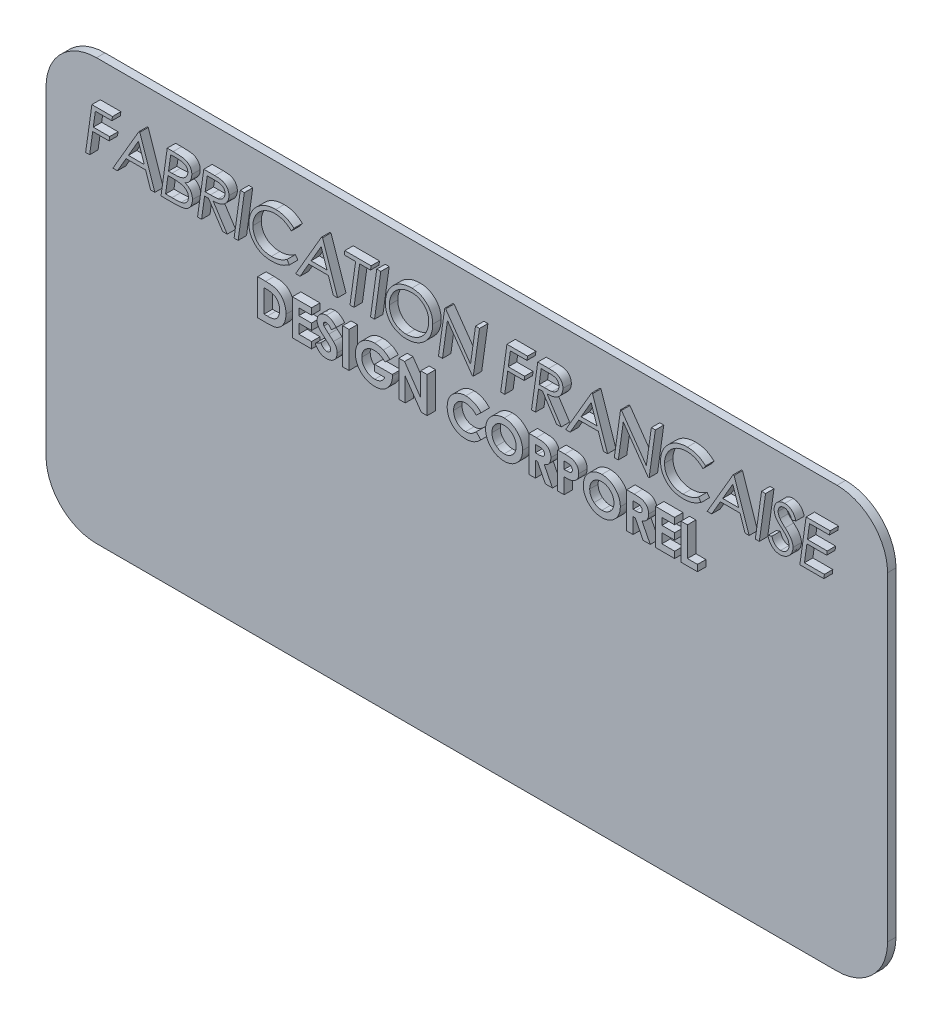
SolidWorks part; units mm, degrees
ref_plane "Plan de face" through (0, 0, 0) normal (0, 0, 1) x (1, 0, 0)
ref_plane "Plan de dessus" through (0, 0, 0) normal (0, 1, 0) x (1, 0, 0)
ref_plane "Plan de droite" through (0, 0, 0) normal (1, 0, 0) x (0, 0, -1)
sketch "Esquisse1" plane through (0, 0, 0) normal (0, 0, 1) x (1, 0, 0)
  line L0 (-25, 12.5) -> (25, -12.5) construction
  line L1 (-22, -12.5) -> (22, -12.5)
  line L2 (-25, -9.5) -> (-25, 9.5)
  line L3 (-22, 12.5) -> (22, 12.5)
  line L4 (25, -9.5) -> (25, 9.5)
  arc A0 (-25, 9.5) -> (-22, 12.5) centre (-22, 9.5) cw
  arc A1 (-22, -12.5) -> (-25, -9.5) centre (-22, -9.5) cw
  arc A2 (22, -12.5) -> (25, -9.5) centre (22, -9.5) ccw
  arc A3 (22, 12.5) -> (25, 9.5) centre (22, 9.5) cw
  point P14 (25, 12.5)
  dimension "D3" = 3
  dimension "D1" = 50
  dimension "D2" = 25
extrude "Extrusion1" add sketch "Esquisse1" along normal blind 0.5
sketch "Esquisse2" plane through (0, 0, 0.5) normal (0, 0, 1) x (1, 0, 0)
  text T0 "FABRICATION FRANCAISE" font "Century Gothic" height in points 10
extrude "Extrusion2" add sketch "Esquisse2" along normal blind 0.5
sketch "Esquisse3" plane through (0, 0, 0.5) normal (0, 0, 1) x (1, 0, 0)
  text T0 "DESIGN CORPOREL" font "Century Gothic" height in points 8
extrude "Extrusion3" add sketch "Esquisse3" along normal blind 0.5
